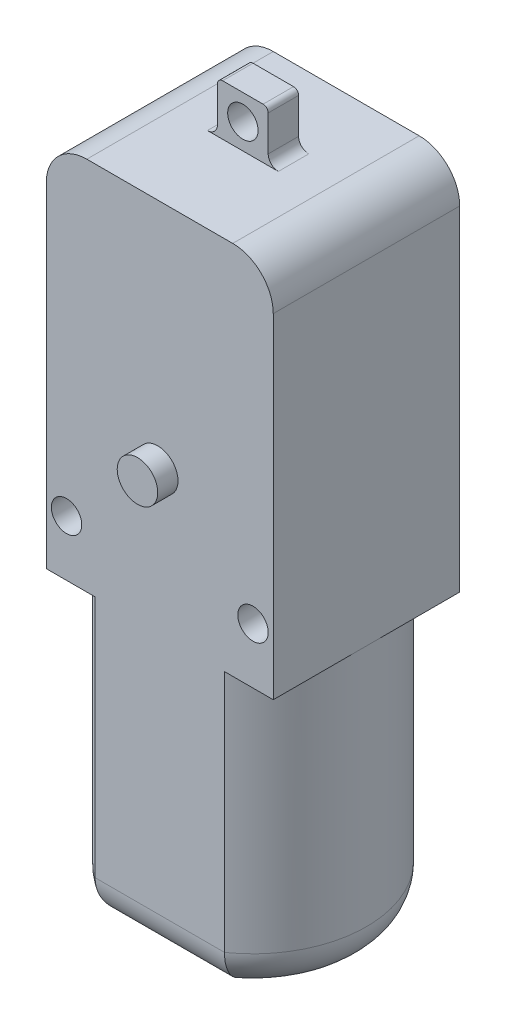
SolidWorks part; units mm, degrees
ref_plane "Plan de face" through (0, 0, 0) normal (0, 0, 1) x (1, 0, 0)
ref_plane "Plan de dessus" through (0, 0, 0) normal (0, 1, 0) x (1, 0, 0)
ref_plane "Plan de droite" through (0, 0, 0) normal (1, 0, 0) x (0, 0, -1)
sketch "Esquisse1" plane through (0, 0, 0) normal (0, 0, 1) x (1, 0, 0)
  line L1 (0, 0) -> (22.4, 0)
  line L2 (0, 0) -> (0, 33)
  line L3 (4, 37) -> (18.4, 37)
  line L4 (22.4, 0) -> (22.4, 33)
  arc A0 (22.4, 33) -> (18.4, 37) centre (18.4, 33) ccw
  arc A1 (0, 33) -> (4, 37) centre (4, 33) cw
  dimension "D3" = 4
  dimension "D1" = 22.4
  dimension "D2" = 37
extrude "Boss.-Extru.1" add sketch "Esquisse1" along normal blind 18.4
sketch "Esquisse2" plane through (0, 0, 0) normal (0, -1, 0) x (1, 0, 0)
  line L0 (0, 18.4) -> (22.4, 0) construction
  line L1 (22.4, 18.4) -> (0, 0) construction
  line L2 (0, 18.4) -> (22.4, 18.4) construction
  line L3 (0, 0) -> (22.4, 0) construction
  line L4 (4.8125, 18.4) -> (17.5875, 18.4)
  line L5 (17.5875, 0) -> (4.8125, 0)
  arc A1 (4.8125, 18.4) -> (4.8125, 0) centre (11.2, 9.2) ccw
  arc A2 (17.5875, 0) -> (17.5875, 18.4) centre (11.2, 9.2) ccw
extrude "Boss.-Extru.2" add sketch "Esquisse2" along normal blind 28
fillet "Congé3" radius 4 4 edges at (11.2, -28, 18.4) (22.4, -28, 9.2) (11.2, -28, 0) (0, -28, 9.2)
sketch "Esquisse3" plane through (0, -28, 0) normal (0, -1, 0) x (1, 0, 0)
  line L0 (6.22, 14.4) -> (16.18, 4) construction
  line L1 (16.18, 4) -> (16.18, 14.4) construction
  line L2 (16.18, 14.4) -> (6.22, 4) construction
  line L3 (6.22, 4) -> (6.22, 14.4) construction
  circle A0 centre (11.2, 9.2) radius 1.0957
extrude "Boss.-Extru.3" add sketch "Esquisse3" along normal blind 2
fillet "Congé4" radius 0.2 1 edges at (11.2, -30, 8.1043)
sketch "Esquisse4" plane through (0, 0, 0) normal (0, 0, -1) x (-1, 0, 0)
  line L0 (-18.4, 37) -> (-4, 37) construction
  line L2 (0, 33) -> (0, 0) construction
  circle A0 centre (-11, 26) radius 2.75
  dimension "D1" = 5.5
  dimension "D2" = 11
  dimension "D3" = 11
extrude "Boss.-Extru.4" add sketch "Esquisse4" along normal blind 2
sketch "Esquisse7" plane through (0, 0, 0) normal (0, 0, -1) x (-1, 0, 0)
  line L0 (-17.5875, 0) -> (-22.4, 0) construction
  line L1 (-22.4, 0) -> (-22.4, 33) construction
  line L2 (0, 0) -> (-4.8125, 0) construction
  line L3 (0, 33) -> (0, 0) construction
  circle A0 centre (-2, 5.5) radius 1.5
  circle A1 centre (-20.4, 5.5) radius 1.5
  dimension "D3" = 3
  dimension "D4" = 3
  dimension "D1" = 5.5
  dimension "D2" = 2
  dimension "D5" = 5.5
  dimension "D6" = 2
extrude "Enlèv. mat.-Extru.1" cut sketch "Esquisse7" against normal blind 2000
sketch "Esquisse8" plane through (0, 0, 18.4) normal (0, 0, 1) x (1, 0, 0)
  line L0 (0, 33) -> (0, 0) construction
  line L1 (0, 0) -> (4.8125, 0) construction
  circle A0 centre (11, 14) radius 2
  dimension "D3" = 4
  dimension "D1" = 11
  dimension "D2" = 14
extrude "Boss.-Extru.6" add sketch "Esquisse8" along normal blind 2
sketch "Esquisse9" plane through (0, 37, 0) normal (0, 1, 0) x (1, 0, 0)
  line L0 (18.4, 0) -> (4, 0) construction
  line L1 (8.5, -7) -> (13.5, -7)
  line L2 (8.5, -7) -> (8.5, -10)
  line L3 (8.5, -10) -> (13.5, -10)
  line L4 (13.5, -7) -> (13.5, -10)
  line L5 (0, -18.4) -> (0, 0) construction
  dimension "D1" = 3
  dimension "D2" = 5
  dimension "D3" = 7
  dimension "D4" = 8.5
extrude "Boss.-Extru.7" add sketch "Esquisse9" along normal blind 5
sketch "Esquisse10" plane through (0, 0, 7) normal (0, 0, -1) x (-1, 0, 0)
  line L0 (-13.5, 42) -> (-8.5, 37) construction
  line L1 (-8.5, 37) -> (-8.5, 42) construction
  line L2 (-8.5, 42) -> (-13.5, 37) construction
  line L3 (-13.5, 37) -> (-13.5, 42) construction
  circle A0 centre (-11, 39.5) radius 1.5
  dimension "D1" = 3
extrude "Enlèv. mat.-Extru.2" cut sketch "Esquisse10" against normal blind 5
fillet "Congé5" radius 1 2 edges at (8.5, 37, 8.5) (13.5, 37, 8.5)
fillet "Congé6" radius 0.5 2 edges at (13.5, 42, 8.5) (8.5, 42, 8.5)
